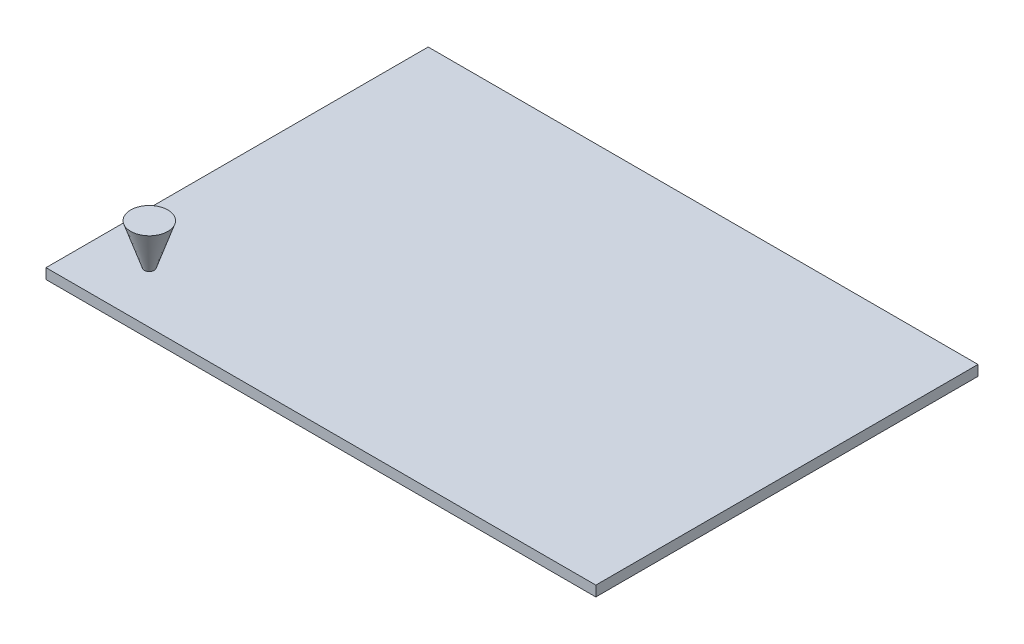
SolidWorks part; units mm, degrees
other "MainBody"
ref_plane "Front Plane" through (0, 0, 0) normal (0, 0, 1) x (1, 0, 0)
ref_plane "Top Plane" through (0, 0, 0) normal (0, 1, 0) x (1, 0, 0)
ref_plane "Right Plane" through (0, 0, 0) normal (1, 0, 0) x (0, 0, -1)
sketch "Sketch1" plane through (0, 0, 0) normal (0, 1, 0) x (1, 0, 0)
  line L0 (-12.7, -12.7) -> (122.5035, 81.2798) construction
  line L1 (-12.7, 81.2798) -> (122.5035, 81.2798)
  line L2 (-12.7, 81.2798) -> (-12.7, -12.7)
  line L3 (-12.7, -12.7) -> (122.5035, -12.7)
  line L4 (122.5035, 81.2798) -> (122.5035, -12.7)
  dimension "D1" = 0
  dimension "D2" = 0
extrude "Extrude1" add sketch "Sketch1" along normal blind 0
sketch "Sketch2" plane through (0, 0, 0) normal (0, 0, 1) x (1, 0, 0)
  line L0 (0, 1.7495) -> (0, 12.5487) construction
  line L1 (0, -6.9018) -> (0, 6.9018) construction
  line L2 (0, 12.5487) -> (4.5686, 12.5487)
  line L3 (4.5686, 12.5487) -> (0.9364, 1.7495)
  line L4 (0.9364, 1.7495) -> (0, 1.7495)
  line L5 (0, 1.7495) -> (0, 12.5487)
revolve "Revolve1" add sketch "Sketch2" about L0
sketch "Sketch3" plane through (0, 2.54, 0) normal (0, 1, 0) x (1, 0, 0)
  line L0 (12.7, 12.7) -> (12.7, 9.525)
  line L1 (6.35, 6.35) -> (103.4535, 6.35) construction
  line L2 (0, 0) -> (109.8035, 0) construction
  line L3 (6.35, 62.2298) -> (6.35, 6.35) construction
  line L4 (0, 68.5798) -> (0, 0) construction
  line L5 (109.8035, 68.5798) -> (0, 68.5798) construction
  line L6 (103.4535, 62.2298) -> (6.35, 62.2298) construction
  line L7 (12.7, 55.8798) -> (12.7, 12.7) construction
  line L8 (6.35, 59.0548) -> (6.35, 6.35)
  line L9 (15.875, 6.35) -> (100.2785, 6.35)
  line L10 (103.4535, 9.525) -> (103.4535, 59.0548)
  line L11 (100.2785, 62.2298) -> (9.525, 62.2298)
  line L12 (0, 68.5798) -> (0, 0)
  line L13 (0, 0) -> (109.8035, 0)
  line L14 (109.8035, 0) -> (109.8035, 68.5798)
  line L15 (109.8035, 68.5798) -> (0, 68.5798)
  line L16 (0, 65.4048) -> (0, 0)
  line L17 (9.525, 0) -> (106.6285, 0)
  line L18 (109.8035, 3.175) -> (109.8035, 65.4048)
  line L19 (106.6285, 68.5798) -> (3.175, 68.5798)
  line L20 (12.7, 52.7048) -> (12.7, 12.7)
  line L21 (97.1035, 55.8798) -> (12.7, 55.8798) construction
  line L22 (97.1035, 12.7) -> (97.1035, 52.7048)
  line L23 (93.9285, 55.8798) -> (15.875, 55.8798)
  line L24 (6.35, 3.175) -> (6.35, 6.35)
  line L25 (12.7, 12.7) -> (97.1035, 12.7) construction
  line L26 (97.1035, 12.7) -> (97.1035, 55.8798) construction
  line L27 (103.4535, 6.35) -> (103.4535, 62.2298) construction
  line L28 (109.8035, 0) -> (109.8035, 68.5798) construction
  arc A0 (0, 65.4048) -> (3.175, 68.5798) centre (3.175, 65.4048) cw
  arc A1 (6.35, 59.0548) -> (9.525, 62.2298) centre (9.525, 59.0548) cw
  arc A2 (12.7, 52.7048) -> (15.875, 55.8798) centre (15.875, 52.7048) cw
  arc A3 (6.35, 3.175) -> (9.525, 0) centre (9.525, 3.175) ccw
  arc A4 (12.7, 9.525) -> (15.875, 6.35) centre (15.875, 9.525) ccw
  arc A5 (97.1035, 52.7048) -> (93.9285, 55.8798) centre (93.9285, 52.7048) ccw
  arc A6 (103.4535, 59.0548) -> (100.2785, 62.2298) centre (100.2785, 59.0548) ccw
  arc A7 (109.8035, 65.4048) -> (106.6285, 68.5798) centre (106.6285, 65.4048) ccw
  arc A8 (106.6285, 0) -> (109.8035, 3.175) centre (106.6285, 3.175) ccw
  arc A9 (100.2785, 6.35) -> (103.4535, 9.525) centre (100.2785, 9.525) ccw
  dimension "D1" = 0
  dimension "D2" = 0
  dimension "D3" = 0
  dimension "D4" = 0
  dimension "D5" = 0
